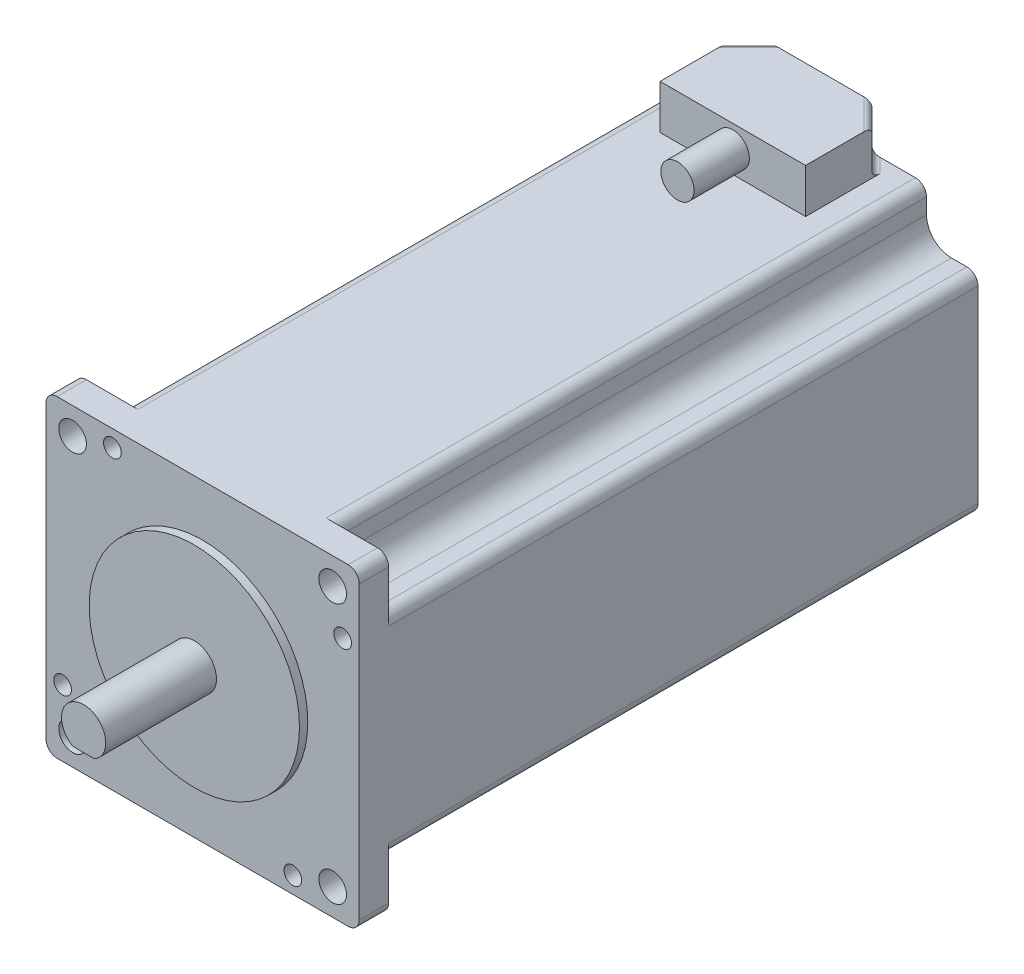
SolidWorks part; units mm, degrees
ref_plane "Front Plane" through (0, 0, 0) normal (0, 0, 1) x (1, 0, 0)
ref_plane "Top Plane" through (0, 0, 0) normal (0, 1, 0) x (1, 0, 0)
ref_plane "Right Plane" through (0, 0, 0) normal (1, 0, 0) x (0, 0, -1)
sketch "Croquis1" plane through (0, 0, 0) normal (0, 0, 1) x (1, 0, 0)
  line L1 (-28.3, 28.3) -> (28.3, 28.3)
  line L2 (-28.3, 28.3) -> (-28.3, -28.3)
  line L3 (-28.3, -28.3) -> (28.3, -28.3)
  line L4 (28.3, 28.3) -> (28.3, -28.3)
  line L5 (-28.3, 28.3) -> (28.3, -28.3) construction
  line L6 (-28.3, -28.3) -> (28.3, 28.3) construction
  point P0 (0, 0)
  dimension "D1" = 56.6
extrude "Saliente-Extruir1" add sketch "Croquis1" along normal blind 5.3
sketch "Croquis2" plane through (0, 0, 0) normal (0, 0, -1) x (-1, 0, 0)
  line L1 (-28.3, 28.3) -> (28.3, 28.3)
  line L2 (-28.3, 28.3) -> (-28.3, -28.3)
  line L3 (-28.3, -28.3) -> (28.3, -28.3)
  line L4 (28.3, 28.3) -> (28.3, -28.3)
  line L5 (-28.3, 28.3) -> (28.3, -28.3) construction
  line L6 (-28.3, -28.3) -> (28.3, 28.3) construction
  circle A0 centre (28.3, -28.3) radius 7.5
  circle A2 centre (0, 0) radius 3.3335 construction
  circle A3 centre (-28.3, -28.3) radius 7.5
  circle A4 centre (0, 0) radius 3.3335 construction
  circle A5 centre (-28.3, 28.3) radius 7.5
  circle A6 centre (0, 0) radius 3.3335 construction
  circle A7 centre (28.3, 28.3) radius 7.5
  circle A8 centre (0, 0) radius 3.3335 construction
  point P0 (0, 0)
  point P22 (0, 0)
  dimension "D1" = 15
  dimension "D2" = 4
extrude "Saliente-Extruir2" add sketch "Croquis2" along normal blind 106.5 contours A7 L1 A5 L2 A3 L3 A0 L4
sketch "Croquis3" plane through (0, 0, 5.3) normal (0, 0, 1) x (1, 0, 0)
  circle A0 centre (0, 0) radius 19
  dimension "D1" = 38
extrude "Saliente-Extruir3" add sketch "Croquis3" along normal blind 1.5
sketch "Croquis4" plane through (0, 0, 6.8) normal (0, 0, 1) x (1, 0, 0)
  circle A0 centre (0, 0) radius 4
  dimension "D1" = 8
extrude "Saliente-Extruir4" add sketch "Croquis4" along normal blind 20
sketch "Croquis5" plane through (0, 0, 26.8) normal (0, 0, 1) x (1, 0, 0)
  line L0 (-1.9365, -3.5) -> (1.9365, -3.5)
  circle A1 centre (0, 0) radius 4
  circle A2 centre (0, 0) radius 4
  point P5 (0, 4)
  dimension "D2" = 7.5
  dimension "D1" = 0
extrude "Cortar-Extruir2" cut sketch "Croquis5" against normal blind 18 contours L0 M3
sketch "Croquis6" plane through (0, 0, 5.3) normal (0, 0, 1) x (1, 0, 0)
  line L0 (0, 0) -> (23.5, 23.5) construction
  line L1 (23.5, 23.5) -> (28.3, 28.3) construction
  line L2 (23.5, 23.5) -> (23.5, 28.3) construction
  line L3 (28.3, 28.3) -> (-28.3, 28.3) construction
  line L4 (23.5, 23.5) -> (28.3, 23.5) construction
  line L5 (28.3, -28.3) -> (28.3, 28.3) construction
  line L6 (-23.5, 23.5) -> (-28.3, 23.5) construction
  line L7 (-28.3, 28.3) -> (-28.3, -28.3) construction
  circle A0 centre (23.5, 23.5) radius 2.5
  circle A1 centre (-23.5, 23.5) radius 2.5
  circle A2 centre (-23.5, -23.5) radius 2.5
  circle A3 centre (23.5, -23.5) radius 2.5
  dimension "D3" = 5
  dimension "D1" = 47
  dimension "D2" = 47
extrude "Cortar-Extruir3" cut sketch "Croquis6" against normal blind 18
fillet "Redondeo2" radius 2 4 edges at (-28.3, -28.3, 2.65) (-28.3, 28.3, 2.65) (28.3, -28.3, 2.65) (28.3, 28.3, 2.65)
sketch "Croquis7" plane through (0, 28.3, 0) normal (0, 1, 0) x (1, 0, 0)
  line L0 (-20.8, 106.5) -> (20.8, 106.5) construction
  line L1 (-13.15, 106.5) -> (13.15, 106.5)
  line L2 (-13.15, 106.5) -> (-13.15, 90.5)
  line L3 (-13.15, 90.5) -> (13.15, 90.5)
  line L4 (13.15, 106.5) -> (13.15, 90.5)
  point P6 (0, 106.5)
  point P7 (0, 106.5)
  dimension "D1" = 16
  dimension "D2" = 26.3
extrude "Saliente-Extruir5" add sketch "Croquis7" along normal blind 8
chamfer "Chaflán1" distance 4 angle 45 2 edges at (13.15, 32.3, -106.5) (-13.15, 32.3, -106.5)
sketch "Croquis8" plane through (0, 0, -90.5) normal (0, 0, 1) x (1, 0, 0)
  line L0 (-13.15, 36.3) -> (13.15, 28.3) construction
  circle A0 centre (0, 32.3) radius 3
  dimension "D1" = 6
extrude "Saliente-Extruir6" add sketch "Croquis8" along normal blind 10
sketch "Croquis10" plane through (0, 0, -106.5) normal (0, 0, -1) x (-1, 0, 0)
  line L0 (-23.5, 23.5) -> (-41.7412, 23.5) construction
  line L1 (-23.5, 19) -> (-41.7412, 19)
  line L2 (-23.5, 28) -> (-41.7412, 28)
  line L3 (-23.5, 23.5) -> (-23.5, 41.7412) construction
  line L4 (-28, 23.5) -> (-28, 41.7412)
  line L5 (-19, 23.5) -> (-19, 41.7412)
  line L6 (23.5, 19) -> (41.7412, 19)
  line L7 (23.5, 28) -> (41.7412, 28)
  line L8 (28, 23.5) -> (28, 41.7412)
  line L9 (19, 23.5) -> (19, 41.7412)
  line L10 (23.5, 23.5) -> (23.5, 41.7412) construction
  line L11 (23.5, 23.5) -> (41.7412, 23.5) construction
  line L12 (19, -23.5) -> (19, -41.7412)
  line L13 (28, -23.5) -> (28, -41.7412)
  line L14 (23.5, -28) -> (41.7412, -28)
  line L15 (23.5, -19) -> (41.7412, -19)
  line L16 (23.5, -23.5) -> (41.7412, -23.5) construction
  line L17 (23.5, -23.5) -> (23.5, -41.7412) construction
  line L18 (-23.5, -19) -> (-41.7412, -19)
  line L19 (-23.5, -28) -> (-41.7412, -28)
  line L20 (-28, -23.5) -> (-28, -41.7412)
  line L21 (-19, -23.5) -> (-19, -41.7412)
  line L22 (-23.5, -23.5) -> (-23.5, -41.7412) construction
  line L23 (-23.5, -23.5) -> (-41.7412, -23.5) construction
  arc A0 (-23.5, 19) -> (-23.5, 28) centre (-23.5, 23.5) ccw
  arc A1 (-41.7412, 28) -> (-41.7412, 19) centre (-41.7412, 23.5) ccw
  arc A2 (-28, 23.5) -> (-19, 23.5) centre (-23.5, 23.5) ccw
  arc A3 (-19, 41.7412) -> (-28, 41.7412) centre (-23.5, 41.7412) ccw
  circle A4 centre (0, 0) radius 9.2353
  arc A5 (23.5, 28) -> (23.5, 19) centre (23.5, 23.5) ccw
  arc A6 (41.7412, 19) -> (41.7412, 28) centre (41.7412, 23.5) ccw
  arc A7 (19, 23.5) -> (28, 23.5) centre (23.5, 23.5) ccw
  arc A8 (28, 41.7412) -> (19, 41.7412) centre (23.5, 41.7412) ccw
  arc A9 (28, -23.5) -> (19, -23.5) centre (23.5, -23.5) ccw
  arc A10 (19, -41.7412) -> (28, -41.7412) centre (23.5, -41.7412) ccw
  arc A11 (23.5, -19) -> (23.5, -28) centre (23.5, -23.5) ccw
  arc A12 (41.7412, -28) -> (41.7412, -19) centre (41.7412, -23.5) ccw
  arc A13 (-23.5, -28) -> (-23.5, -19) centre (-23.5, -23.5) ccw
  arc A14 (-41.7412, -19) -> (-41.7412, -28) centre (-41.7412, -23.5) ccw
  arc A15 (-19, -23.5) -> (-28, -23.5) centre (-23.5, -23.5) ccw
  arc A16 (-28, -41.7412) -> (-19, -41.7412) centre (-23.5, -41.7412) ccw
  point P3 (-32.6206, 23.5)
  point P10 (-23.5, 32.6206)
  point P23 (23.5, 32.6206)
  point P30 (32.6206, 23.5)
  point P37 (32.6206, -23.5)
  point P44 (23.5, -32.6206)
  point P51 (-23.5, -32.6206)
  point P58 (-32.6206, -23.5)
  point P63 (0, 0)
  dimension "D1" = 4.5
  dimension "D2" = 4
extrude "Cortar-Extruir4" cut sketch "Croquis10" against normal up to surface (106.5 mm away) contours A2 L1 M21 M22 | A2 A0 M21 | A0 L5 M20 M21 | A5 L9 M27 M28 | A5 A7 M27 | A7 L6 M26 M27 | A9 A11 M25 | A11 L12 M24 M25 | A9 L15 M25 M26 | A15 L18 M22 M23 | A13 A15 M23 | A13 L21 M23 M24
fillet "Redondeo3" radius 1 4 edges at (11.15, 28.3, -104.5) (11.15, 36.3, -104.5) (-11.15, 36.3, -104.5) (-11.15, 28.3, -104.5)
sketch "Sketch1" plane through (0, 0, -106.5) normal (0, 0, -1) x (-1, 0, 0)
  line L2 (28.3, 26.3) -> (28.3, -26.3) construction
  line L3 (-26.3, 28.3) -> (26.3, 28.3) construction
  circle A0 centre (16.3, 25.3) radius 1.6
  dimension "D3" = 3.2
  dimension "D1" = 12
  dimension "D2" = 3
extrude "Cut-Extrude1" cut sketch "Sketch1" against normal blind 150
fillet "Fillet1" radius 2 8 edges at (28.3, 19, -53.25) (19, 28.3, -53.25) (19, -28.3, -53.25) (28.3, -19, -53.25) (-19, -28.3, -53.25) (-28.3, -19, -53.25) (-28.3, 19, -53.25) (-19, 28.3, -53.25)
pattern_circular "CirPattern1" count 4 over 360 about axis through (0, 0, 0) along (0, 0, 1) of "Cut-Extrude1"
